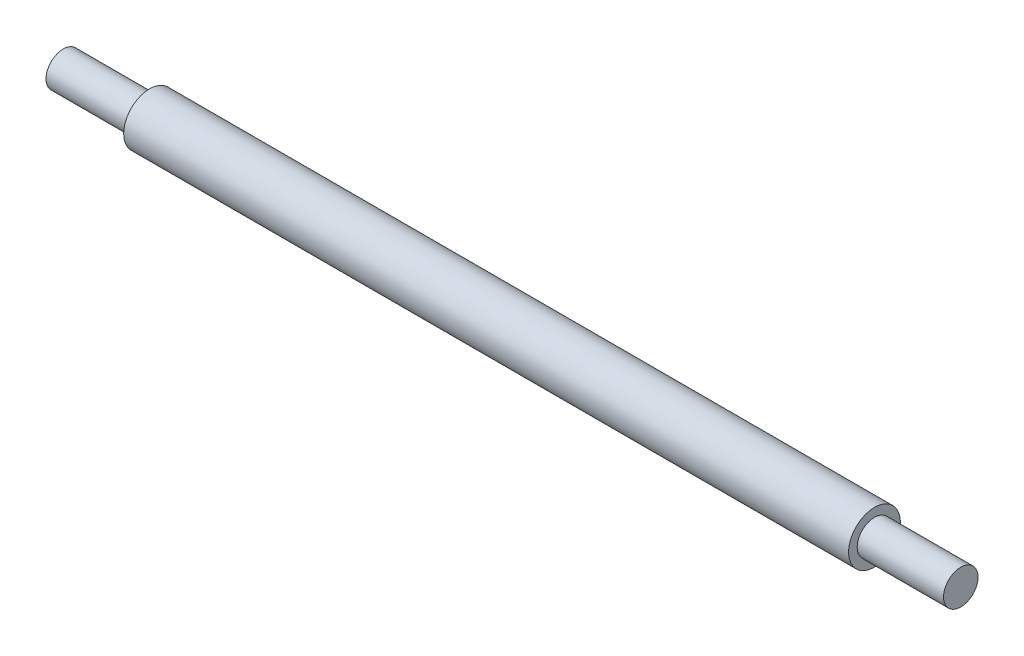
SolidWorks part; units mm, degrees
ref_plane "Front Plane" through (0, 0, 0) normal (0, 0, 1) x (1, 0, 0)
ref_plane "Top Plane" through (0, 0, 0) normal (0, 1, 0) x (1, 0, 0)
ref_plane "Right Plane" through (0, 0, 0) normal (1, 0, 0) x (0, 0, -1)
sketch "Sketch1" plane through (0, 0, 0) normal (0, 0, 1) x (1, 0, 0)
  line L0 (0, 0) -> (0, 2)
  line L1 (0, 2) -> (10, 2)
  line L2 (10, 2) -> (10, 3)
  line L3 (10, 3) -> (94, 3)
  line L4 (94, 3) -> (94, 2)
  line L5 (94, 2) -> (104, 2)
  line L6 (104, 2) -> (104, 0)
  line L7 (104, 0) -> (0, 0)
  line L8 (-34.0069, 0) -> (0, 0) construction
  dimension "D1" = 10
  dimension "D2" = 104
  dimension "D3" = 10
  dimension "D4" = 4
  dimension "D5" = 6
revolve "Revolve1" add sketch "Sketch1" angle 360 about L8
